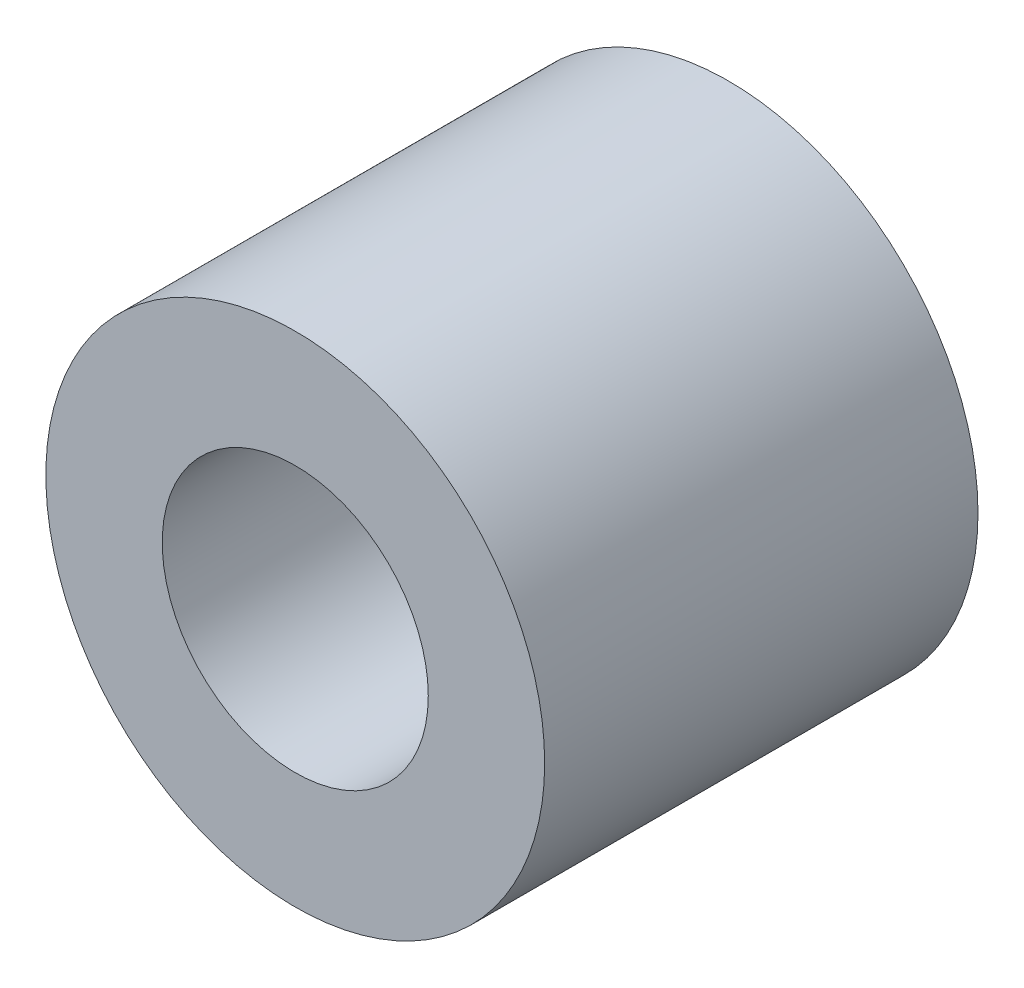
SolidWorks part; units mm, degrees
ref_plane "Alzado" through (0, 0, 0) normal (0, 0, 1) x (1, 0, 0)
ref_plane "Planta" through (0, 0, 0) normal (0, 1, 0) x (1, 0, 0)
ref_plane "Vista lateral" through (0, 0, 0) normal (1, 0, 0) x (0, 0, -1)
sketch "Croquis1" plane through (0, 0, 0) normal (0, 0, 1) x (1, 0, 0)
  circle A0 centre (0, 0) radius 7.5
  circle A1 centre (0, 0) radius 4
  dimension "D1" = 15
  dimension "D2" = 8
extrude "Saliente-Extruir1" add sketch "Croquis1" along normal mid plane 13.03
